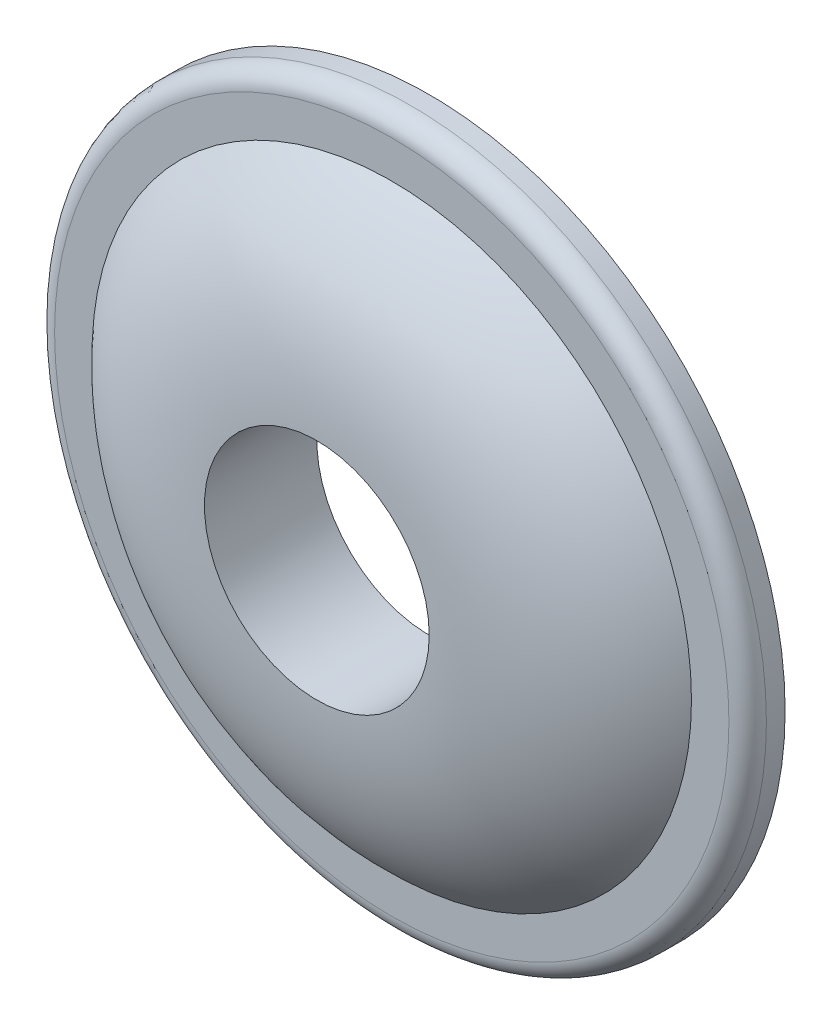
SolidWorks part; units mm, degrees
ref_plane "Спереди" through (0, 0, 0) normal (0, 0, 1) x (1, 0, 0)
ref_plane "Сверху" through (0, 0, 0) normal (0, 1, 0) x (1, 0, 0)
ref_plane "Справа" through (0, 0, 0) normal (1, 0, 0) x (0, 0, -1)
sketch "Эскиз1" plane through (0, 0, 0) normal (1, 0, 0) x (0, 0, -1)
  line L0 (0, 0) -> (3, 0) construction
  line L1 (0, 3) -> (3, 3)
  line L2 (3, 3) -> (3, 9.5)
  line L3 (3, 9.5) -> (2.5, 9.5)
  line L4 (2, 9) -> (2, 8)
  line L5 (0, 3.6574) -> (0, 2.3327) construction
  arc A0 (2.5, 9.5) -> (2, 9) centre (2.5, 9) ccw
  spline S0 degree 2 poles (0, 3) (0, 6.2003) (2, 8) knots 0 0 0 1 1 1
  dimension "D6" = 0.5
  dimension "D1" = 3
  dimension "D2" = 9.5
  dimension "D3" = 3
  dimension "D4" = 1
  dimension "D5" = 8
revolve "Повернуть1" add sketch "Эскиз1" angle 360 about L0
